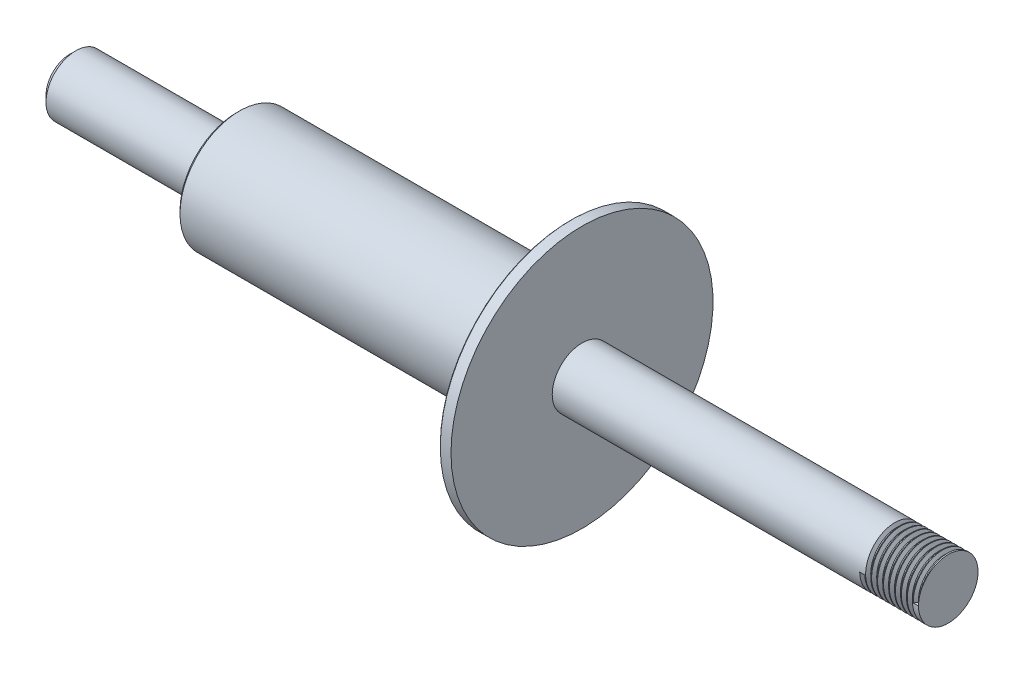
SolidWorks part; units mm, degrees
ref_plane "Piano frontale" through (0, 0, 0) normal (0, 0, 1) x (1, 0, 0)
ref_plane "Piano superiore" through (0, 0, 0) normal (0, 1, 0) x (1, 0, 0)
ref_plane "Piano destro" through (0, 0, 0) normal (1, 0, 0) x (0, 0, -1)
sketch "Schizzo2" plane through (0, 0, 0) normal (0, 1, 0) x (1, 0, 0)
  line L0 (0, 0) -> (0, 4)
  line L1 (1, 5) -> (25, 5)
  line L2 (26, 4.05) -> (26, 0)
  line L3 (0, 4) -> (1, 5)
  line L4 (25, 5) -> (26, 4.05)
  line L5 (84, 21.8) -> (84.2, 22)
  line L6 (28, 4.05) -> (26, 4.05)
  line L7 (28.5, 10) -> (81, 10)
  line L8 (81, 10) -> (81, 0)
  line L9 (84, 0) -> (84, 9.85)
  line L10 (0, 0) -> (191.0544, 0) construction
  line L11 (84, 9.85) -> (81, 9.85)
  line L12 (84, 0) -> (84, 21.8)
  line L13 (84.2, 22) -> (86, 22)
  line L14 (86, 22) -> (86, 0)
  line L15 (86, 0) -> (86, 5)
  line L16 (86, 5) -> (147.5, 5)
  line L17 (147.5, 5) -> (147.5, 0)
  line L18 (28, 0) -> (28, 9.5)
  line L19 (28, 9.5) -> (28.5, 10)
  point P1 (0, 5)
  point P4 (26, 5)
  point P11 (84, 4.925)
  point P18 (84, 22)
  point P24 (28, 10)
  dimension "D6" = 61.5
  dimension "D1" = 5
  dimension "D2" = 26
  dimension "D3" = 53
  dimension "D4" = 2
  dimension "D5" = 3
  dimension "D7" = 22
  dimension "D10" = 84
  dimension "D11" = 2
  dimension "D12" = 4.05
  dimension "D9" = 10
  dimension "D13" = 9.85
  dimension "D14" = 5
revolve "Rivoluzione1" add sketch "Schizzo2" angle 360 about L10
thread "Filettatura1" pitch 1 start angle 0, offset 0, length 9, pitch 1, diameter 10
ref_plane "Piano1" through (147.5, 0, 5) normal (0, -1, 0) x (0, 0, 1)
sketch "Profilo filettatura1" plane through (147.5, 0, 5) normal (0, -1, 0) x (0, 0, 1)
  line L0 (0, 0) -> (0, 1) construction
  line L11 (0, 0) -> (0, 0.875)
  line L12 (0, 0.875) -> (-0.5413, 0.5625)
  line L13 (-0.5413, 0.5625) -> (-0.5413, 0.3125)
  line L15 (-0.5413, 0.3125) -> (0, 0)
  line L17 (-0.5413, 0.4375) -> (0, 0.4375) construction
  point P2 (0, 0)
  dimension "Pitch" = 1
  dimension "Profile_Angle" = 60
  dimension "Profile_Land" = 0.25
  dimension "Profile_Height" = 0.5413
